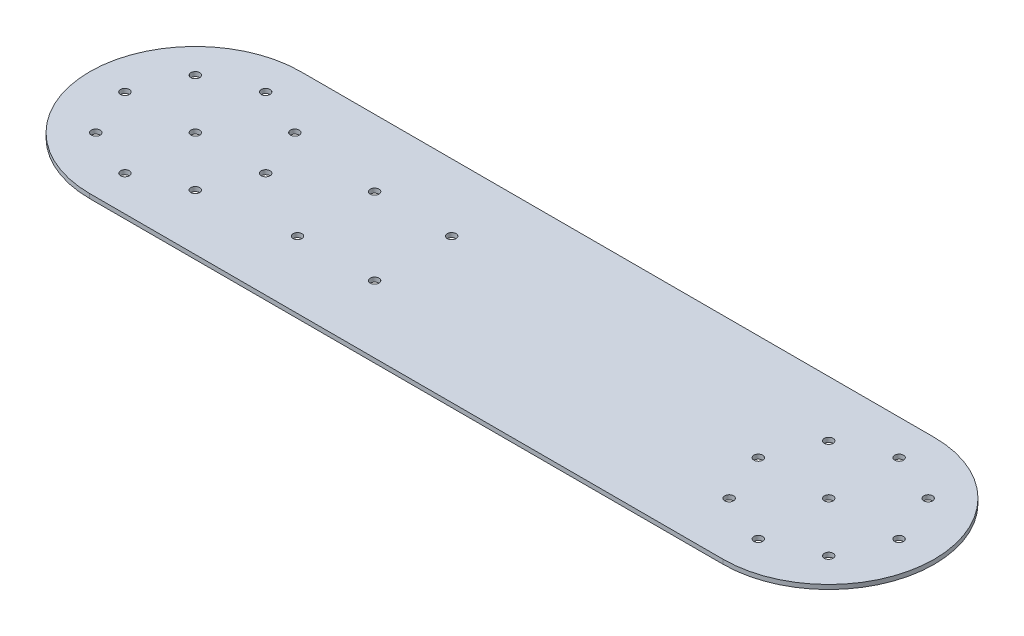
SolidWorks part; units mm, degrees
ref_plane "Front Plane" through (0, 0, 0) normal (0, 0, 1) x (1, 0, 0)
ref_plane "Top Plane" through (0, 0, 0) normal (0, 1, 0) x (1, 0, 0)
ref_plane "Right Plane" through (0, 0, 0) normal (1, 0, 0) x (0, 0, -1)
sketch "Sketch1" plane through (0, 0, 0) normal (0, 1, 0) x (1, 0, 0)
  line L0 (0, 0) -> (0, 171.3006) construction
  line L1 (-228.6, -76.2) -> (228.6, -76.2)
  line L3 (-228.6, 76.2) -> (228.6, 76.2)
  line L5 (-228.6, -76.2) -> (228.6, 76.2) construction
  line L6 (-228.6, 76.2) -> (228.6, -76.2) construction
  arc A1 (-228.6, 76.2) -> (-228.6, -76.2) centre (-228.6, 0) ccw
  arc A4 (228.6, 76.2) -> (228.6, -76.2) centre (228.6, 0) cw
  circle A20 centre (-127, 27.813) radius 3.175
  circle A21 centre (-127, -27.813) radius 3.175
  circle A23 centre (-71.374, -27.813) radius 3.175
  circle A24 centre (-71.374, 27.813) radius 3.175
  point P0 (0, 0)
  point P38 (-228.6, 0)
  point P41 (-304.8, 0)
  point P62 (-304.8, 0)
  point P71 (304.8, 0)
extrude "Boss-Extrude1" add sketch "Sketch1" along normal blind 3.175
sketch "Sketch3" plane through (0, 3.175, 0) normal (0, 1, 0) x (1, 0, 0)
  circle A0 centre (-228.6, 50.8) radius 3.175
  circle A3 centre (-127, 27.813) radius 3.175 construction
  circle A4 centre (-228.6, 0) radius 3.175
  arc A5 (-228.6, 76.2) -> (-228.6, -76.2) centre (-228.6, 0) ccw construction
  dimension "D1" = 50.8
extrude "Cut-Extrude1" cut sketch "Sketch3" against normal through all
pattern_circular "CirPattern1" count 8 over 360 about axis through (-228.6, 0, 0) along (0, 1, 0) of "Cut-Extrude1"
mirror "Mirror1" about plane through (0, 0, 0) normal (1, 0, 0) of "CirPattern1", "Cut-Extrude1"
equation "\"D4@Sketch1\"= 0.5 * \"D1@Sketch1\""
equation "\"D9@Sketch1\"= 0.5 * \"D11@Sketch1\""
equation "\"D8@Sketch1\"= \"D11@Sketch1\""
